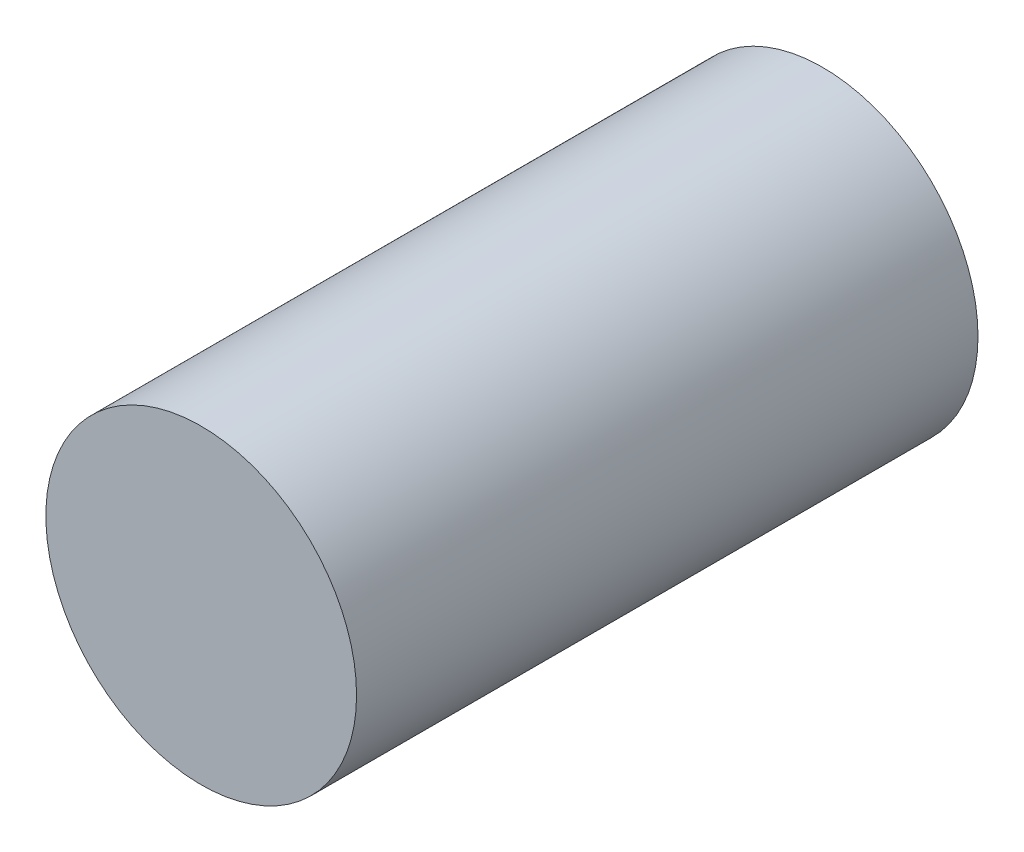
SolidWorks part; units mm, degrees
ref_plane "Front Plane" through (0, 0, 0) normal (0, 0, 1) x (1, 0, 0)
ref_plane "Top Plane" through (0, 0, 0) normal (0, 1, 0) x (1, 0, 0)
ref_plane "Right Plane" through (0, 0, 0) normal (1, 0, 0) x (0, 0, -1)
sketch "Sketch1" plane through (0, 0, 0) normal (0, 0, 1) x (1, 0, 0)
  circle A0 centre (0, 0) radius 7.5
  dimension "D1" = 15
extrude "Boss-Extrude1" add sketch "Sketch1" along normal mid plane 30
